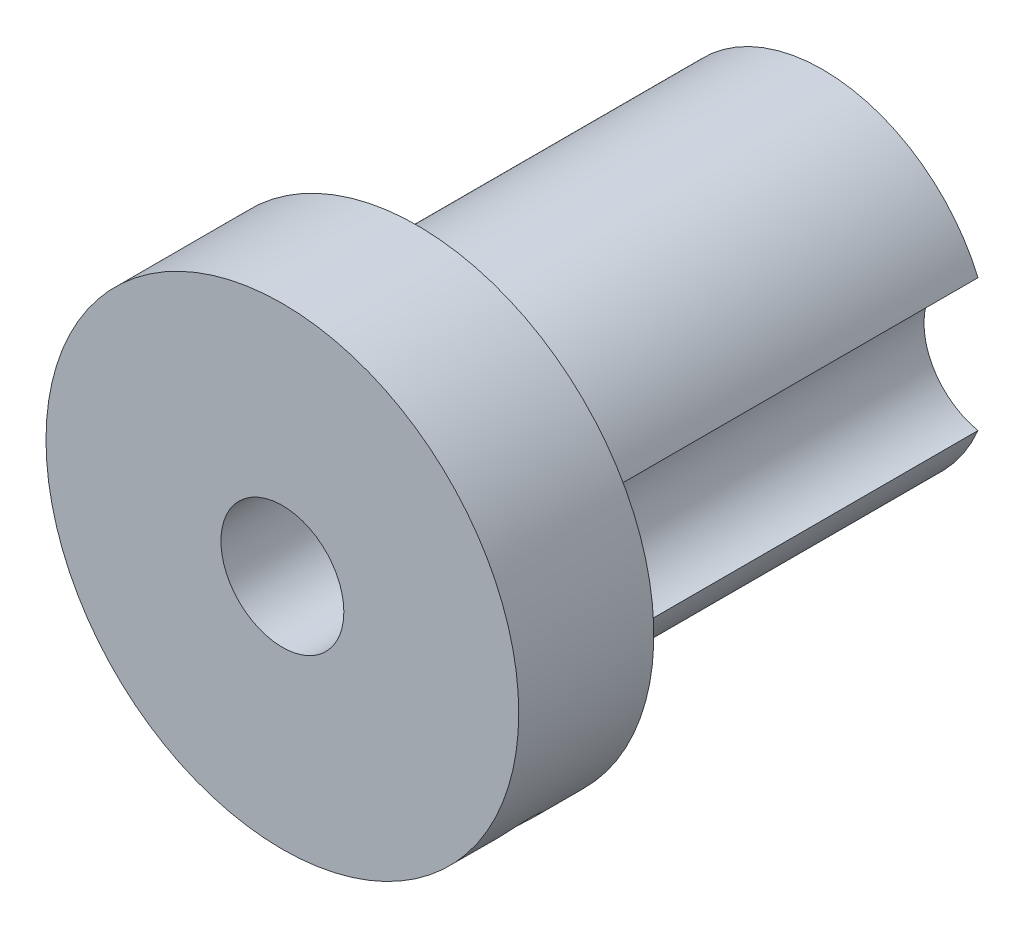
SolidWorks part; units mm, degrees
ref_plane "前视基准面" through (0, 0, 0) normal (0, 0, 1) x (1, 0, 0)
ref_plane "上视基准面" through (0, 0, 0) normal (0, 1, 0) x (1, 0, 0)
ref_plane "右视基准面" through (0, 0, 0) normal (1, 0, 0) x (0, 0, -1)
sketch "草图1" plane through (0, 0, 0) normal (0, 0, 1) x (1, 0, 0)
  circle A0 centre (0, 0) radius 35
  circle A1 centre (0, 0) radius 9.1
extrude "凸台-拉伸1" add sketch "草图1" along normal blind 80
sketch "草图2" plane through (0, 0, 0) normal (0, 0, -1) x (-1, 0, 0)
  circle A0 centre (0, 0) radius 25
extrude "切除-拉伸1" cut sketch "草图2" against normal blind 60 flip side to cut
sketch "草图3" plane through (0, 0, 60) normal (0, 0, -1) x (-1, 0, 0)
  circle A0 centre (0, 30) radius 1.65
  circle A1 centre (30, 0) radius 1.65
  circle A2 centre (0, -30) radius 1.65
  circle A3 centre (-30, 0) radius 1.65
extrude "切除-拉伸2" cut sketch "草图3" against normal blind 15
sketch "草图4" plane through (0, 0, 60) normal (0, 0, -1) x (-1, 0, 0)
  arc A0 (-23, -9.798) -> (-23, 9.798) centre (-25, 0) ccw
  arc A1 (23, 9.798) -> (23, -9.798) centre (25, 0) ccw
  arc A2 (-23, 9.798) -> (-23, -9.798) centre (0, 0) ccw
  arc A3 (23, -9.798) -> (23, 9.798) centre (0, 0) ccw
extrude "切除-拉伸3" cut sketch "草图4" along normal through all
ref_plane "基准面4" through (24.7487, -24.7487, 0) normal (0.7071, -0.7071, 0) x (0, 0, -1)
sketch "草图5" plane through (24.7487, -24.7487, 0) normal (0.7071, -0.7071, 0) x (0, 0, -1)
  circle A0 centre (-70, 0) radius 3
extrude "切除-拉伸4" cut sketch "草图5" against normal up to next
